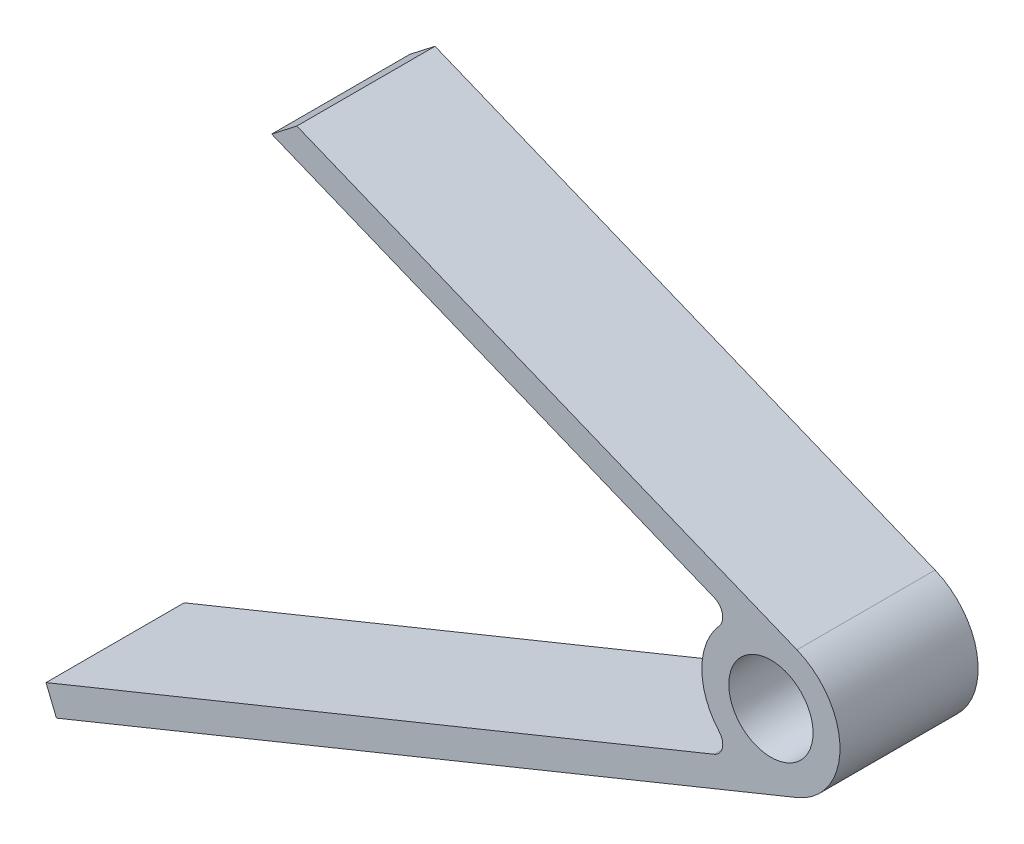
SolidWorks part; units mm, degrees
ref_plane "Спереди" through (0, 0, 0) normal (0, 0, 1) x (1, 0, 0)
ref_plane "Сверху" through (0, 0, 0) normal (0, 1, 0) x (1, 0, 0)
ref_plane "Справа" through (0, 0, 0) normal (1, 0, 0) x (0, 0, -1)
sketch "Эскиз1" plane through (0, 0, 0) normal (0, 0, 1) x (1, 0, 0)
  line L0 (-34.3141, 19.3668) -> (1.8852, 4.631)
  line L1 (-51.7181, -26.4515) -> (1.8852, -4.631)
  line L2 (-62.266, 0) -> (25.8844, 0) construction
  line L3 (0, 22.6415) -> (0, -14.9648) construction
  line L4 (-18.1908, 12.8034) -> (-18.1908, 0) construction
  line L5 (-18.1908, 0) -> (-18.1908, -12.8034) construction
  line L6 (-52.4722, -24.5991) -> (-4.1083, -4.9114)
  line L7 (-51.7181, -26.4515) -> (-52.4722, -24.5991)
  line L8 (-36.1376, 17.9498) -> (-4.1083, 4.9114)
  line L9 (-36.1376, 17.9498) -> (-34.3141, 19.3668)
  circle A0 centre (0, 0) radius 3.05
  arc A1 (1.8852, -4.631) -> (1.8852, 4.631) centre (0, 0) ccw
  arc A2 (-3.7378, 3.321) -> (-3.7378, -3.321) centre (0, 0) ccw
  arc A3 (-4.1083, -4.9114) -> (-3.7378, -3.321) centre (-4.4853, -3.9852) ccw
  arc A4 (-4.1083, 4.9114) -> (-3.7378, 3.321) centre (-4.4853, 3.9852) cw
  point P22 (-2.5737, 4.2867)
  dimension "D1" = 6.1
  dimension "D2" = 10
  dimension "D9" = 1
  dimension "D3" = 44.3
  dimension "D4" = 58.09
  dimension "D5" = 40.35
  dimension "D6" = 2
  dimension "D7" = 2
  dimension "D8" = 60
extrude "Бобышка-Вытянуть1" add sketch "Эскиз1" along normal blind 10
